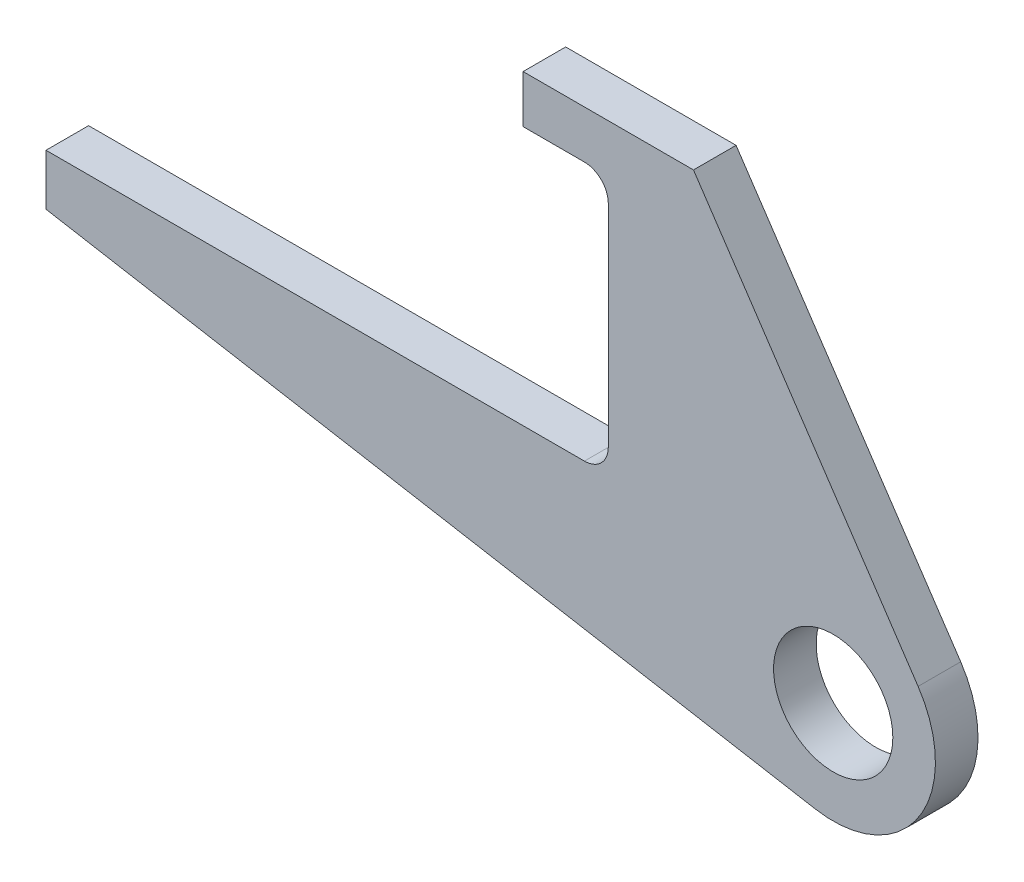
SolidWorks part; units mm, degrees
ref_plane "Plan de face" through (0, 0, 0) normal (0, 0, 1) x (1, 0, 0)
ref_plane "Plan de dessus" through (0, 0, 0) normal (0, 1, 0) x (1, 0, 0)
ref_plane "Plan de droite" through (0, 0, 0) normal (1, 0, 0) x (0, 0, -1)
sketch "Esquisse1" plane through (0, 0, 0) normal (0, 0, 1) x (1, 0, 0)
  line L0 (-462, 50) -> (-146, 50)
  line L1 (-132, 64) -> (-132, 188)
  line L2 (-182, 202) -> (-182, 230)
  line L3 (-82, 230) -> (49.8319, 33.4183)
  line L4 (-10.3507, -59.1005) -> (-462, 20)
  line L5 (-462, 50) -> (-462, 20)
  line L6 (0, 0) -> (-152.2132, 0) construction
  line L7 (0, 0) -> (-159.5658, -62.7582) construction
  line L8 (-182, 202) -> (-146, 202)
  line L9 (-82, 230) -> (-182, 230)
  arc A0 (49.8319, 33.4183) -> (-10.3507, -59.1005) centre (0, 0) cw
  arc A1 (-146, 202) -> (-132, 188) centre (-146, 188) cw
  circle A2 centre (0, 0) radius 35
  arc A3 (-146, 50) -> (-132, 64) centre (-146, 64) ccw
  point P4 (60, 0)
  point P15 (0, -60)
  point P18 (-132, 202)
  point P21 (-132, 50)
  dimension "D7" = 60
  dimension "D8" = 100
  dimension "D10" = 70
  dimension "D12" = 522
  dimension "D14" = 14
  dimension "D1" = 132
  dimension "D2" = 50
  dimension "D4" = 28
  dimension "D5" = 152
  dimension "D6" = 330
  dimension "D9" = 21.47
  dimension "D11" = 50
  dimension "D13" = 30
extrude "Extrusion1" add sketch "Esquisse1" along normal blind 25
